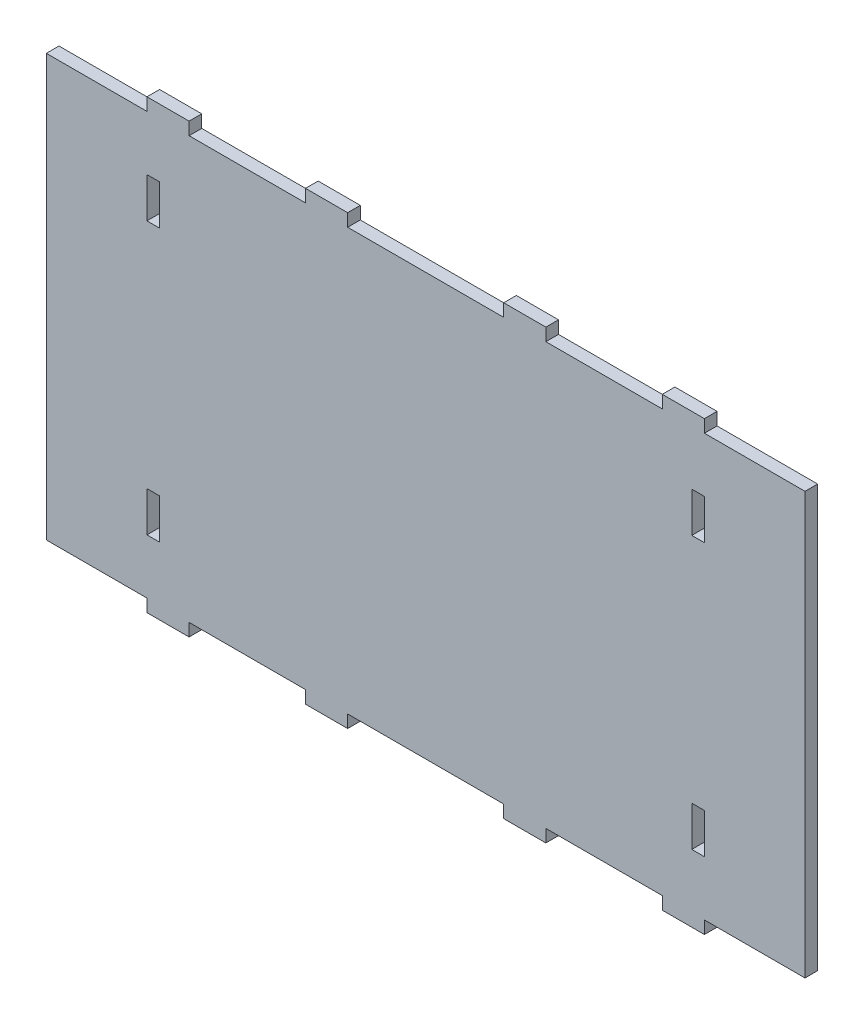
SolidWorks part; units mm, degrees
ref_plane "Plan de face" through (0, 0, 0) normal (0, 0, 1) x (1, 0, 0)
ref_plane "Plan de dessus" through (0, 0, 0) normal (0, 1, 0) x (1, 0, 0)
ref_plane "Plan de droite" through (0, 0, 0) normal (1, 0, 0) x (0, 0, -1)
sketch "Esquisse1" plane through (0, 0, 0) normal (0, 0, 1) x (1, 0, 0)
  line L0 (-90, 0) -> (-66.1305, 0)
  line L1 (-66.1305, 0) -> (-66.1305, -3)
  line L2 (-66.1305, -3) -> (-56.1305, -3)
  line L3 (-56.1305, -3) -> (-56.1305, 0)
  line L4 (-56.1305, 0) -> (-28.5112, 0)
  line L5 (-28.5112, 0) -> (-28.5112, -3)
  line L6 (-28.5112, -3) -> (-18.5112, -3)
  line L7 (-18.5112, -3) -> (-18.5112, 0)
  line L8 (-18.5112, 0) -> (18.5112, 0)
  line L9 (0, 26.5232) -> (0, -22.5938) construction
  line L10 (18.5112, -3) -> (18.5112, 0)
  line L11 (28.5112, -3) -> (18.5112, -3)
  line L12 (28.5112, 0) -> (28.5112, -3)
  line L13 (56.1305, 0) -> (28.5112, 0)
  line L14 (56.1305, -3) -> (56.1305, 0)
  line L15 (66.1305, -3) -> (56.1305, -3)
  line L16 (66.1305, 0) -> (66.1305, -3)
  line L17 (90, 0) -> (66.1305, 0)
  line L18 (-90, 0) -> (-90, 100)
  line L19 (-90, 50) -> (90, 50) construction
  line L20 (90, 100) -> (90, 0)
  line L21 (90, 100) -> (66.1305, 100)
  line L22 (66.1305, 100) -> (66.1305, 103)
  line L23 (66.1305, 103) -> (56.1305, 103)
  line L24 (56.1305, 103) -> (56.1305, 100)
  line L25 (56.1305, 100) -> (28.5112, 100)
  line L26 (28.5112, 100) -> (28.5112, 103)
  line L27 (28.5112, 103) -> (18.5112, 103)
  line L28 (18.5112, 103) -> (18.5112, 100)
  line L29 (-18.5112, 100) -> (18.5112, 100)
  line L30 (-18.5112, 103) -> (-18.5112, 100)
  line L31 (-28.5112, 103) -> (-18.5112, 103)
  line L32 (-28.5112, 100) -> (-28.5112, 103)
  line L33 (-56.1305, 100) -> (-28.5112, 100)
  line L34 (-56.1305, 103) -> (-56.1305, 100)
  line L35 (-66.1305, 103) -> (-56.1305, 103)
  line L36 (-66.1305, 100) -> (-66.1305, 103)
  line L37 (-90, 100) -> (-66.1305, 100)
  point P25 (0, 0)
  point P35 (0, 100)
  dimension "D1" = 100
extrude "Boss.-Extru.1" add sketch "Esquisse1" along normal blind 3
sketch "Esquisse2" plane through (0, 0, 3) normal (0, 0, 1) x (1, 0, 0)
  line L0 (66.1305, 12.986) -> (63.1305, 12.986) construction
  line L1 (66.1305, 22.4928) -> (66.1305, 12.986) construction
  line L2 (63.1305, 22.4928) -> (63.1305, 12.986) construction
  line L3 (66.1305, 22.4928) -> (63.1305, 22.4928) construction
  line L4 (66.1305, 12.986) -> (63.1305, 12.986)
  line L5 (66.1305, 22.4928) -> (66.1305, 12.986)
  line L6 (63.1305, 22.4928) -> (63.1305, 12.986)
  line L7 (66.1305, 22.4928) -> (63.1305, 22.4928)
  line L8 (0, 0) -> (0, 58.7412) construction
  line L9 (-66.1305, 22.4928) -> (-63.1305, 22.4928)
  line L10 (-63.1305, 22.4928) -> (-63.1305, 12.986)
  line L11 (-66.1305, 22.4928) -> (-66.1305, 12.986)
  line L12 (-66.1305, 12.986) -> (-63.1305, 12.986)
  line L13 (-90, 50) -> (90, 50) construction
  line L14 (-90, 100) -> (-90, 0) construction
  line L15 (90, 0) -> (90, 100) construction
  line L16 (66.1305, 77.5072) -> (63.1305, 77.5072)
  line L17 (63.1305, 77.5072) -> (63.1305, 87.014)
  line L18 (66.1305, 77.5072) -> (66.1305, 87.014)
  line L19 (66.1305, 87.014) -> (63.1305, 87.014)
  line L20 (-66.1305, 87.014) -> (-63.1305, 87.014)
  line L21 (-66.1305, 77.5072) -> (-66.1305, 87.014)
  line L22 (-63.1305, 77.5072) -> (-63.1305, 87.014)
  line L23 (-66.1305, 77.5072) -> (-63.1305, 77.5072)
extrude "Enlèv. mat.-Extru.1" cut sketch "Esquisse2" against normal blind 3
